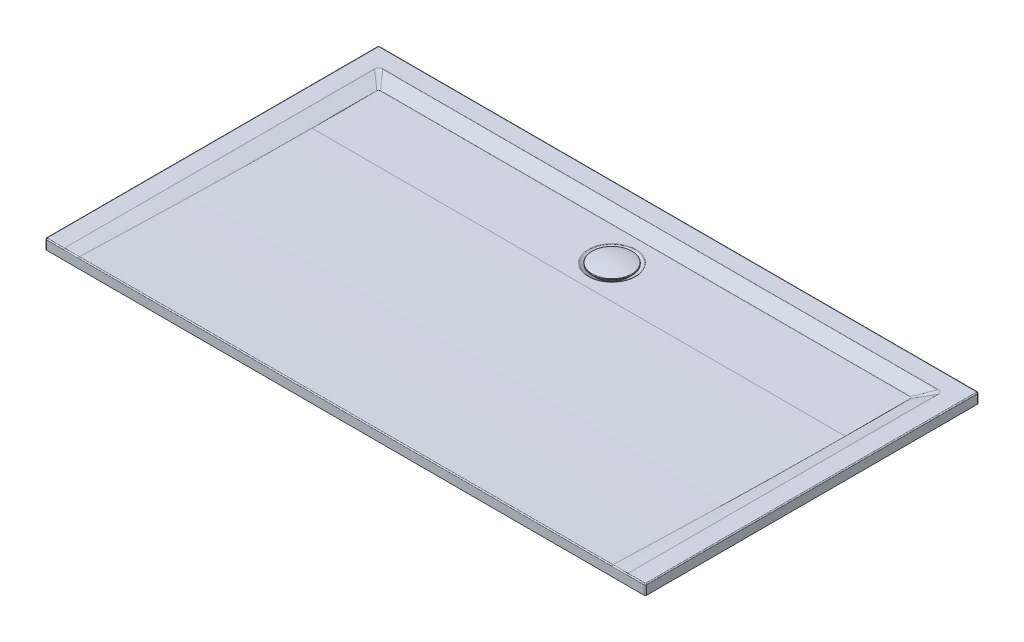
SolidWorks part; units mm, degrees
ref_plane "Płaszczyzna przednia" through (0, 0, 0) normal (0, 0, 1) x (1, 0, 0)
ref_plane "Płaszczyzna górna" through (0, 0, 0) normal (0, 1, 0) x (1, 0, 0)
ref_plane "Płaszczyzna prawa" through (0, 0, 0) normal (1, 0, 0) x (0, 0, -1)
sketch "Szkic1" plane through (0, 0, 0) normal (0, 1, 0) x (1, 0, 0)
  line L0 (0, 500) -> (0, -500) construction
  line L1 (-900, 500) -> (900, 500)
  line L2 (-900, 500) -> (-900, -500)
  line L3 (-900, -500) -> (900, -500)
  line L4 (900, 500) -> (900, -500)
  line L5 (-845, -500) -> (-845, 445)
  line L6 (-845, 445) -> (845, 445)
  line L7 (845, 445) -> (845, -500)
  line L8 (-800, -500) -> (-800, 400)
  line L9 (-800, 400) -> (800, 400)
  line L10 (800, 400) -> (800, -500)
  circle A0 centre (0, 300) radius 45
  circle A1 centre (0, 300) radius 70
  point P9 (0, 445)
  dimension "D6" = 90
  dimension "D7" = 140
  dimension "D1" = 1800
  dimension "D2" = 55
  dimension "D3" = 55
  dimension "D5" = 200
  dimension "D8" = 1000
  dimension "D4" = 45
sketch "Szkic2" plane through (0, 0, 0) normal (0, 1, 0) x (1, 0, 0)
  line L0 (-900, -500) -> (900, -500) construction
  line L1 (900, 500) -> (900, -500) construction
  line L2 (845, 445) -> (845, -500) construction
  line L3 (-845, 445) -> (845, 445) construction
  line L4 (-900, 500) -> (900, 500) construction
  line L5 (-845, -500) -> (-845, 445) construction
  line L6 (-900, 500) -> (-900, -500) construction
  line L7 (-900, -500) -> (-845, -500)
  line L8 (900, 500) -> (900, -500)
  line L9 (845, 445) -> (845, -500)
  line L10 (-845, 445) -> (845, 445)
  line L11 (-900, 500) -> (900, 500)
  line L12 (-845, -500) -> (-845, 445)
  line L13 (-900, 500) -> (-900, -500)
  line L14 (845, -500) -> (900, -500)
surface "Powierzchnia-Płaszczyzna1" sketch "Szkic2"
ref_plane "Płaszczyzna1" through (0, -15, 0) normal (0, 1, 0) x (-1, 0, 0)
sketch "Szkic3" plane through (0, -15, 0) normal (0, 1, 0) x (-1, 0, 0)
  line L0 (800, -200) -> (-800, -200)
  line L1 (800, 500) -> (800, -400) construction
  line L2 (-800, -400) -> (-800, 500) construction
  line L3 (0, -200) -> (0, -400) construction
  line L4 (800, -400) -> (-800, -400) construction
  line L5 (-800, -400) -> (-800, -200)
  line L6 (800, -200) -> (800, -400)
  line L7 (800, -400) -> (-800, -400)
  circle A0 centre (0, -300) radius 70 construction
  circle A1 centre (0, -300) radius 70
  point P10 (0, -300)
surface "Powierzchnia-Płaszczyzna2" sketch "Szkic3"
sketch "Szkic4" plane through (0, 0, 0) normal (0, 1, 0) x (1, 0, 0)
  line L0 (800, -500) -> (-800, -500)
other "Granica-Powierzchnia1"
other "Granica-Powierzchnia2"
other "Granica-Powierzchnia3"
mirror "Lustro1" about plane through (0, 0, 0) normal (1, 0, 0)
sketch "Szkic5" plane through (0, 0, 0) normal (0, 1, 0) x (1, 0, 0)
  line L0 (900, 500) -> (900, -500) construction
  line L1 (-900, 500) -> (900, 500) construction
  line L2 (-900, 500) -> (-900, -500) construction
  line L3 (-900, -500) -> (900, -500) construction
  line L4 (900, 500) -> (900, -500)
  line L5 (-900, 500) -> (900, 500)
  line L6 (-900, 500) -> (-900, -500)
  line L7 (-900, -500) -> (900, -500)
surface "Powierzchnia-Wyciągnięcie1" sketch "Szkic5" parameters "D1"=30
sketch "Szkic7" plane through (0, 0, 0) normal (1, 0, 0) x (0, 0, -1)
  line L0 (300, 0) -> (300, -30) construction
  line L1 (500, -30) -> (-500, -30) construction
  line L2 (345, -30) -> (345, -28)
  line L3 (345, -28) -> (349, -28)
  line L6 (349, -28) -> (370, -15)
  dimension "D1" = 90
  dimension "D2" = 2
  dimension "D3" = 98
surface "Powierzchnia-Obrót wokół linii środkowej1" sketch "Szkic7" parameters "D1"=360
surface "Powierzchnia-Płaszczyzna3"
surface "Powierzchnia-Połącz1"
fillet "Zaokrąglenie1" radius 4 6 edges at (0, -28, -349) (0, -15, -230) (900, -15, 500) (900, -15, -500) (-900, -15, -500) (-900, -15, 500)
fillet "Zmienne zaokrąglenie1" radius 40 2 edges at (822.5, -7.5, -422.5)
fillet "Zaokrąglenie3" radius 3 12 edges
fillet "Zaokrąglenie4" radius 3 12 edges at (-898.8284, 0, -498.8284) (0, 0, -500) (898.8284, 0, -498.8284) (900, 0, 0) (898.8284, 0, 498.8284) (870.5, 0, 500) (-870.5, 0, 500) (-898.8284, 0, 498.8284) (-900, 0, 0)
sketch "Szkic8" plane through (0, 0, 0) normal (1, 0, 0) x (0, 0, -1)
  line L0 (300, 0) -> (300, -30) construction
  line L1 (300, -5.6601) -> (179.8469, -5.6601) construction
  line L2 (360, -14.7573) -> (360, -17)
  line L3 (360, -17) -> (300, -17)
  line L4 (300, -17) -> (300, -5.6601)
  line L5 (300, -5.6601) -> (199.9922, 95.6514)
  arc A0 (300, -5.6601) -> (359.2694, -13.7943) centre (300, -225.6601) cw
  arc A1 (359.2694, -13.7943) -> (360, -14.7573) centre (359, -14.7573) cw
  point P11 (360, -14)
  dimension "D1" = 220
  dimension "D4" = 1
  dimension "D2" = 60
  dimension "D3" = 3
  dimension "D5" = 13
revolve "Obrót wokół linii środkowej1" add sketch "Szkic8" angle 360 about L4
